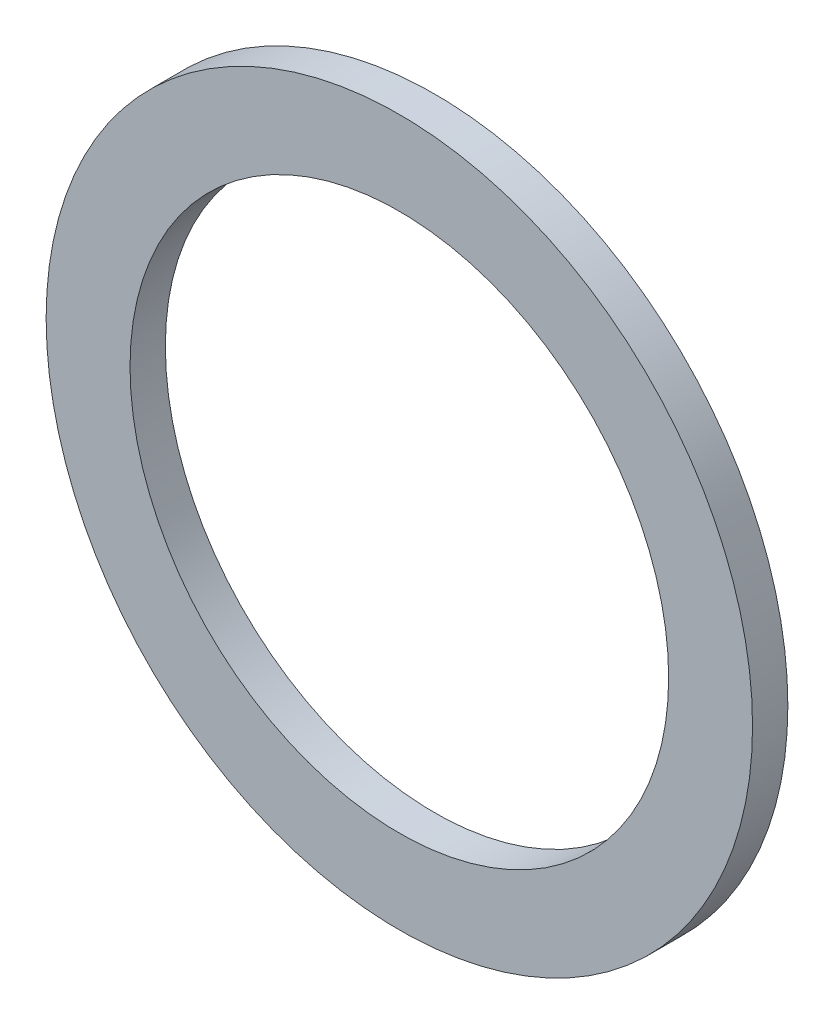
SolidWorks part; units mm, degrees
ref_plane "Plan de face" through (0, 0, 0) normal (0, 0, 1) x (1, 0, 0)
ref_plane "Plan de dessus" through (0, 0, 0) normal (0, 1, 0) x (1, 0, 0)
ref_plane "Plan de droite" through (0, 0, 0) normal (1, 0, 0) x (0, 0, -1)
sketch "Esquisse1" plane through (0, 0, 0) normal (0, 0, 1) x (1, 0, 0)
  circle A0 centre (0, 0) radius 20
  circle A1 centre (0, 0) radius 15.25
  dimension "D1" = 40
  dimension "D2" = 30.5
extrude "Extrusion1" add sketch "Esquisse1" along normal blind 2
